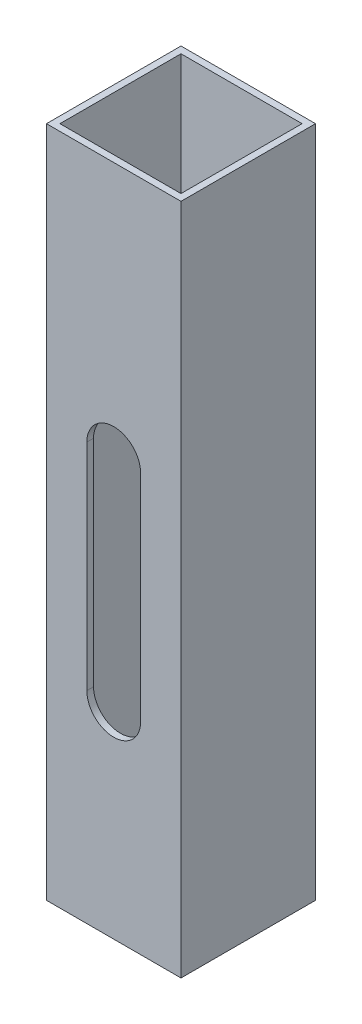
SolidWorks part; units mm, degrees
ref_plane "Plan de face" through (0, 0, 0) normal (0, 0, 1) x (1, 0, 0)
ref_plane "Plan de dessus" through (0, 0, 0) normal (0, 1, 0) x (1, 0, 0)
ref_plane "Plan de droite" through (0, 0, 0) normal (1, 0, 0) x (0, 0, -1)
sketch "Esquisse1" plane through (0, 0, 0) normal (0, 1, 0) x (1, 0, 0)
  line L1 (-100, 100) -> (100, 100)
  line L2 (-100, 100) -> (-100, -100)
  line L3 (-100, -100) -> (100, -100)
  line L4 (100, 100) -> (100, -100)
  line L5 (-100, 100) -> (100, -100) construction
  line L6 (-100, -100) -> (100, 100) construction
  point P0 (0, 0)
  dimension "D1" = 200
  dimension "D2" = 200
extrude "Forme extérieure" add sketch "Esquisse1" along normal blind 1000
shell "Trou" thickness 10
sketch "Esquisse2" plane through (0, 0, 100) normal (0, 0, 1) x (1, 0, 0)
  line L0 (0, 300) -> (0, 620) construction
  line L1 (-40, 300) -> (-40, 620)
  line L2 (40, 300) -> (40, 620)
  line L3 (-100, 0) -> (100, 0) construction
  arc A0 (-40, 300) -> (40, 300) centre (0, 300) ccw
  arc A1 (40, 620) -> (-40, 620) centre (0, 620) ccw
  point P3 (0, 460)
  dimension "D2" = 40
  dimension "D1" = 320
  dimension "D3" = 300
extrude "évidement trappe" cut sketch "Esquisse2" against normal up to next
equation "\"D2@Esquisse1\"=\"D1@Esquisse1\""
